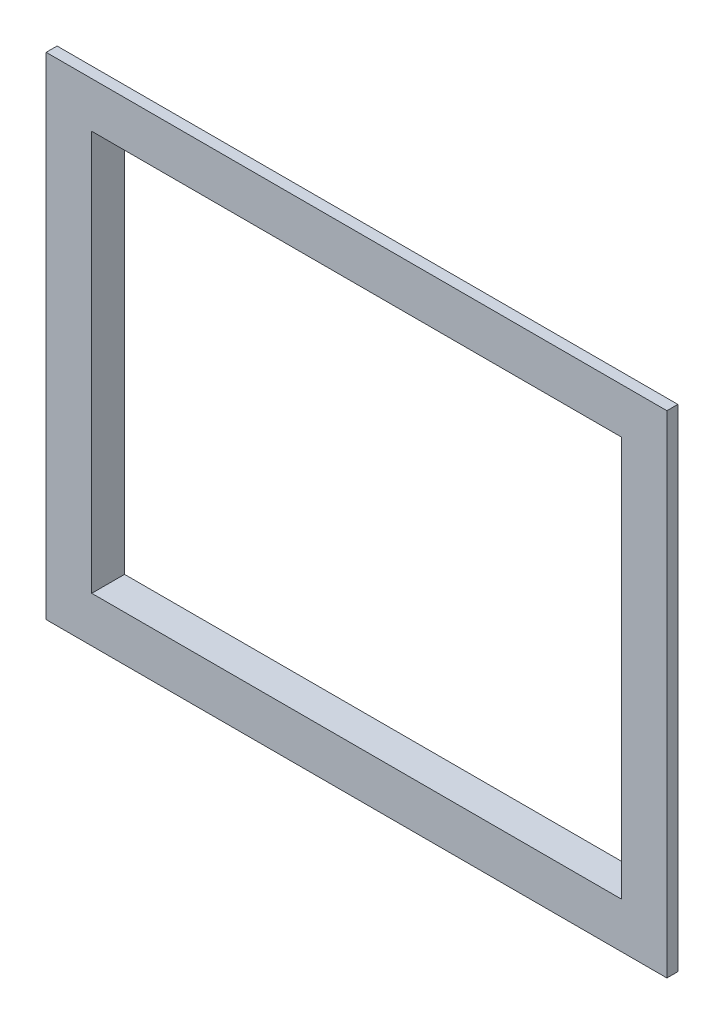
SolidWorks part; units mm, degrees
ref_plane "Front Plane" through (0, 0, 0) normal (0, 0, 1) x (1, 0, 0)
ref_plane "Top Plane" through (0, 0, 0) normal (0, 1, 0) x (1, 0, 0)
ref_plane "Right Plane" through (0, 0, 0) normal (1, 0, 0) x (0, 0, -1)
sketch "TracéZoneEcran" plane through (0, 0, 0) normal (0, 0, 1) x (1, 0, 0)
  line L1 (-28.75, -21.65) -> (28.75, -21.65)
  line L2 (-28.75, -21.65) -> (-28.75, 21.65)
  line L3 (-28.75, 21.65) -> (28.75, 21.65)
  line L4 (28.75, -21.65) -> (28.75, 21.65)
  line L5 (-28.75, -21.65) -> (28.75, 21.65) construction
  line L6 (-28.75, 21.65) -> (28.75, -21.65) construction
  point P0 (0, 0)
  dimension "D1" = 57.5
  dimension "D2" = 43.3
sketch "Esquisse6" plane through (0, 0, 0) normal (0, 0, 1) x (1, 0, 0)
  line L0 (-28.75, 21.65) -> (28.75, 21.65) construction
  line L1 (29.05, -21.95) -> (-29.05, -21.95)
  line L2 (29.05, -21.95) -> (29.05, 21.95)
  line L3 (29.05, 21.95) -> (-29.05, 21.95)
  line L4 (-29.05, -21.95) -> (-29.05, 21.95)
  line L5 (29.05, -21.95) -> (-29.05, 21.95) construction
  line L6 (29.05, 21.95) -> (-29.05, -21.95) construction
  line L8 (-28.75, -21.65) -> (-28.75, 21.65) construction
  line L9 (-34.05, -26.95) -> (-34.05, 26.95)
  line L10 (34.05, 26.95) -> (-34.05, 26.95)
  line L11 (34.05, -26.95) -> (34.05, 26.95)
  line L12 (34.05, -26.95) -> (-34.05, -26.95)
  point P0 (0, 0)
extrude "Boss.-Extru.3" add sketch "Esquisse6" along normal blind 1.2
sketch "Esquisse7" plane through (0, 0, 0) normal (0, 0, -1) x (-1, 0, 0)
  line L0 (-30.55, 23.45) -> (-30.55, -23.45)
  line L1 (-29.05, 21.95) -> (29.05, 21.95)
  line L2 (-29.05, 21.95) -> (-29.05, -21.95)
  line L3 (-29.05, -21.95) -> (29.05, -21.95)
  line L4 (29.05, 21.95) -> (29.05, -21.95)
  line L5 (-30.55, -23.45) -> (30.55, -23.45)
  line L6 (30.55, 23.45) -> (30.55, -23.45)
  line L7 (-30.55, 23.45) -> (30.55, 23.45)
  dimension "D2" = 61.1
  dimension "D3" = 46.9
  dimension "D1" = 1.5
extrude "Boss.-Extru.4" add sketch "Esquisse7" along normal blind 2.4
fillet "Congé1" radius 0.6 4 edges at (30.55, -23.45, -1.2) (-30.55, -23.45, -1.2) (-30.55, 23.45, -1.2) (30.55, 23.45, -1.2)
equation "\"D2@Esquisse6\"=\"D1@Esquisse6\""
